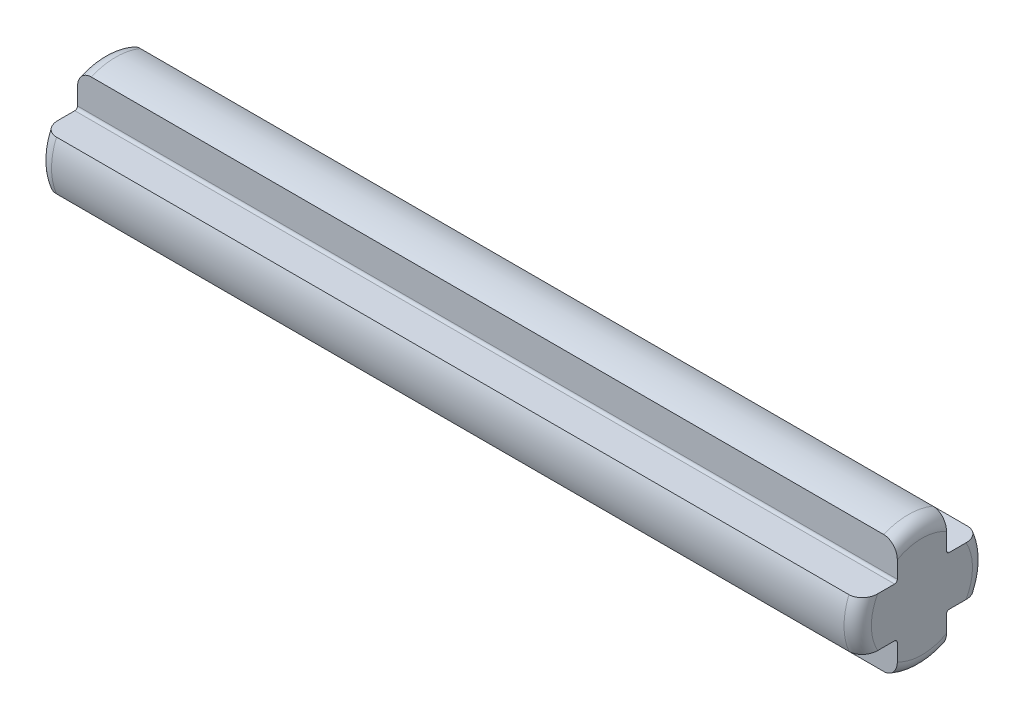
SolidWorks part; units mm, degrees
ref_plane "Alzado" through (0, 0, 0) normal (0, 0, 1) x (1, 0, 0)
ref_plane "Planta" through (0, 0, 0) normal (0, 1, 0) x (1, 0, 0)
ref_plane "Vista lateral" through (0, 0, 0) normal (1, 0, 0) x (0, 0, -1)
sketch "Croquis1" plane through (0, 0, 0) normal (1, 0, 0) x (0, 0, -1)
  line L0 (-3.7919, 0) -> (3.9132, 0) construction
  line L1 (-0.9, 2.1708) -> (-0.9, 1)
  line L2 (-2.1708, 0.9) -> (-1, 0.9)
  line L3 (2.1708, 0.9) -> (1, 0.9)
  line L4 (0.9, 2.1708) -> (0.9, 1)
  line L5 (0, 3.4809) -> (0, -0.8787) construction
  line L6 (0.9, -2.1708) -> (0.9, -1)
  line L7 (2.1708, -0.9) -> (1, -0.9)
  line L8 (-2.1708, -0.9) -> (-1, -0.9)
  line L9 (-0.9, -2.1708) -> (-0.9, -1)
  arc A0 (-2.1708, 0.9) -> (-2.1708, -0.9) centre (0, 0) ccw
  arc A1 (0.9, 2.1708) -> (-0.9, 2.1708) centre (0, 0) ccw
  arc A2 (-1, 0.9) -> (-0.9, 1) centre (-1, 1) ccw
  arc A3 (1, 0.9) -> (0.9, 1) centre (1, 1) cw
  arc A4 (2.1708, 0.9) -> (2.1708, -0.9) centre (0, 0) cw
  arc A5 (1, -0.9) -> (0.9, -1) centre (1, -1) ccw
  arc A6 (-1, -0.9) -> (-0.9, -1) centre (-1, -1) cw
  arc A7 (0.9, -2.1708) -> (-0.9, -2.1708) centre (0, 0) cw
  dimension "D1" = 2.35
  dimension "D4" = 0.1
  dimension "D2" = 1.8
  dimension "D3" = 1.8
extrude "Extruir1" add sketch "Croquis1" along normal mid plane 30
fillet "Redondeo1" radius 0.5 8 edges at (15, 2.35, 0) (15, 0, -2.35) (15, -2.35, 0) (15, 0, 2.35) (-15, -2.35, 0) (-15, 0, -2.35) (-15, 2.35, 0) (-15, 0, 2.35)
